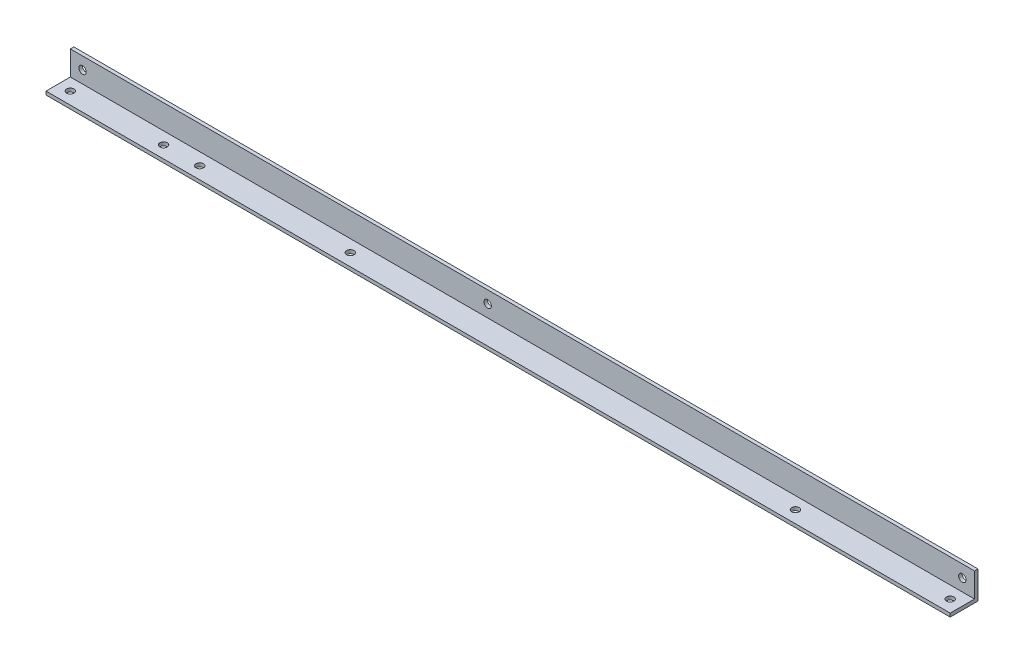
SolidWorks part; units mm, degrees
ref_plane "Front Plane" through (0, 0, 0) normal (0, 0, 1) x (1, 0, 0)
ref_plane "Top Plane" through (0, 0, 0) normal (0, 1, 0) x (1, 0, 0)
ref_plane "Right Plane" through (0, 0, 0) normal (1, 0, 0) x (0, 0, -1)
sketch "Sketch1" plane through (0, 0, 0) normal (0, 1, 0) x (1, 0, 0)
  line L1 (-412.75, 12.7) -> (412.75, 12.7)
  line L2 (-412.75, 12.7) -> (-412.75, -12.7)
  line L3 (-412.75, -12.7) -> (412.75, -12.7)
  line L4 (412.75, 12.7) -> (412.75, -12.7)
  line L5 (-412.75, 12.7) -> (412.75, -12.7) construction
  line L6 (-412.75, -12.7) -> (412.75, 12.7) construction
  point P0 (0, 0)
  dimension "D1" = 825.5
  dimension "D2" = 25.4
extrude "Boss-Extrude1" add sketch "Sketch1" along normal blind 3.175
sketch "Sketch2" plane through (0, 3.175, 0) normal (0, 1, 0) x (1, 0, 0)
  line L0 (-412.75, 12.7) -> (-412.75, 9.525)
  line L1 (-412.75, 12.7) -> (-412.75, -12.7) construction
  line L2 (-412.75, 9.525) -> (412.75, 9.525)
  line L3 (412.75, -12.7) -> (412.75, 12.7) construction
  line L4 (412.75, 9.525) -> (412.75, 12.7)
  line L5 (412.75, 12.7) -> (-412.75, 12.7)
  dimension "D1" = 3.175
extrude "Boss-Extrude2" add sketch "Sketch2" along normal blind 22.225
sketch "Sketch3" plane through (0, 3.175, 0) normal (0, 1, 0) x (1, 0, 0)
  line L0 (-412.75, -1.5875) -> (412.75, -1.5875) construction
  line L1 (-412.75, 9.525) -> (-412.75, -12.7) construction
  line L2 (412.75, -12.7) -> (412.75, 9.525) construction
  line L3 (-412.75, -12.7) -> (412.75, -12.7) construction
  circle A0 centre (-401.6375, -1.5875) radius 3.3782
  circle A1 centre (-316.5475, -1.5875) radius 3.3782
  circle A2 centre (401.6375, -1.5875) radius 3.3782
  circle A3 centre (260.35, -1.5875) radius 3.3782
  circle A4 centre (-283.5275, -1.5875) radius 3.3782
  circle A5 centre (-146.05, -1.5875) radius 3.3782
  dimension "D2" = 6.7564
  dimension "D3" = 6.7564
  dimension "D4" = 6.7564
  dimension "D5" = 6.7564
  dimension "D10" = 6.7564
  dimension "D12" = 6.7564
  dimension "D1" = 11.1125
  dimension "D6" = 11.1125
  dimension "D7" = 96.2025
  dimension "D8" = 11.1125
  dimension "D9" = 152.4
  dimension "D11" = 33.02
  dimension "D13" = 558.8
extrude "Cut-Extrude1" cut sketch "Sketch3" against normal through all
sketch "Sketch4" plane through (0, 0, -9.525) normal (0, 0, 1) x (1, 0, 0)
  line L0 (-412.75, 14.2875) -> (412.75, 14.2875) construction
  line L1 (-412.75, 25.4) -> (-412.75, 3.175) construction
  line L2 (412.75, 25.4) -> (412.75, 3.175) construction
  line L3 (-412.75, 25.4) -> (412.75, 25.4) construction
  circle A0 centre (-401.6375, 14.2875) radius 3.3782
  circle A1 centre (401.6375, 14.2875) radius 3.3782
  circle A2 centre (-31.75, 14.2875) radius 3.3782
  dimension "D2" = 6.7564
  dimension "D4" = 6.7564
  dimension "D5" = 6.7564
  dimension "D1" = 11.1125
  dimension "D3" = 11.1125
  dimension "D6" = 11.1125
  dimension "D7" = 381
extrude "Cut-Extrude2" cut sketch "Sketch4" against normal through all
